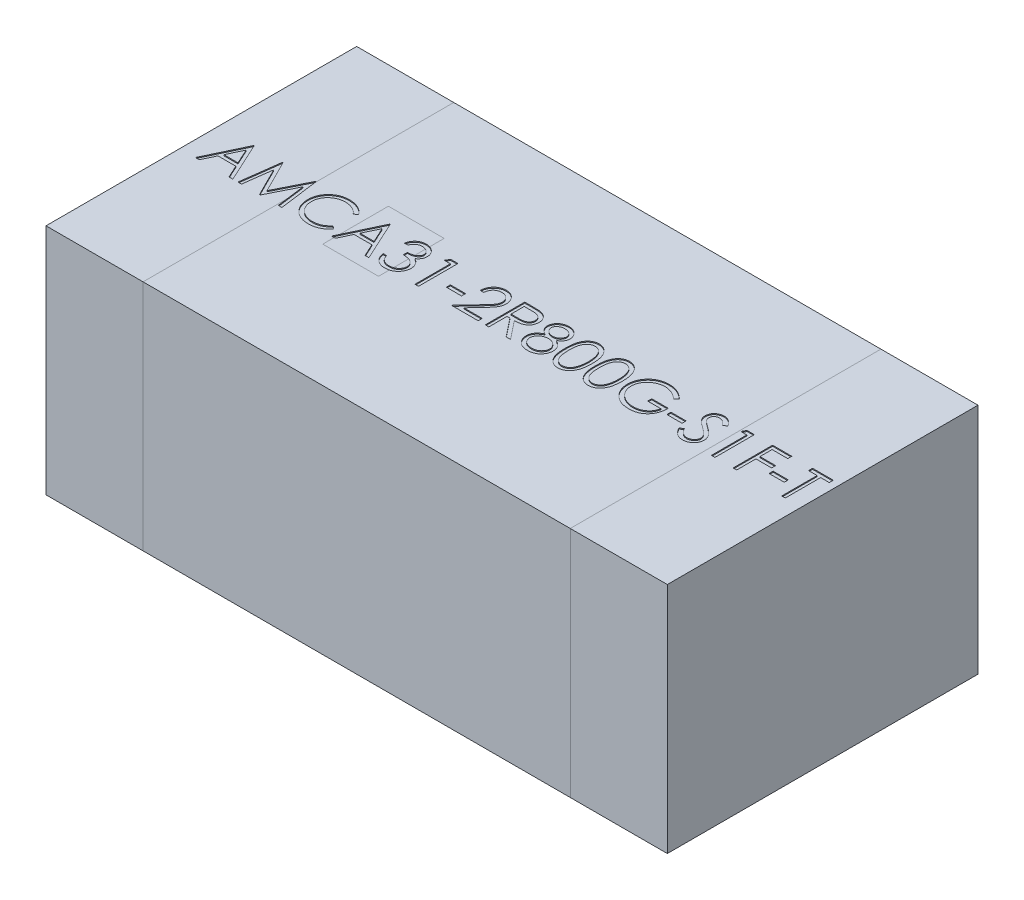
SolidWorks part; units mm, degrees
ref_plane "Front Plane" through (0, 0, 0) normal (0, 0, 1) x (1, 0, 0)
ref_plane "Top Plane" through (0, 0, 0) normal (0, 1, 0) x (1, 0, 0)
ref_plane "Right Plane" through (0, 0, 0) normal (1, 0, 0) x (0, 0, -1)
sketch "Sketch1" plane through (0, 0, 0) normal (0, 1, 0) x (1, 0, 0)
  line L0 (0, 7.4141) -> (0, -8.3625) construction
  line L1 (0, -55) -> (0, 55) construction
  line L2 (10.2951, 0) -> (-9.1134, 0) construction
  line L3 (-55, 0) -> (55, 0) construction
  line L5 (-1.6, 0.8) -> (1.6, 0.8)
  line L6 (-1.6, 0.8) -> (-1.6, -0.8)
  line L7 (-1.6, -0.8) -> (1.6, -0.8)
  line L8 (1.6, 0.8) -> (1.6, -0.8)
  dimension "D1" = 3.2
  dimension "D2" = 1.6
extrude "Boss-Extrude1" add sketch "Sketch1" along normal mid plane 1.2
ref_plane "Plane1" through (-1.1, 0, 0) normal (-1, 0, 0) x (0, 0, 1)
ref_plane "Plane2" through (1.1, 0, 0) normal (1, 0, 0) x (0, 0, -1)
sketch "Sketch18" plane through (0, 0.6, 0) normal (0, 1, 0) x (1, 0, 0)
  text T0 "AMCA31-2R800G-S1F-T" font "Century Gothic" height 0.2032
extrude "Cut-Extrude1" cut sketch "Sketch18" against normal blind 0.005
sketch "Sketch19" plane through (0, 0.6, 0) normal (0, 1, 0) x (1, 0, 0)
  line L0 (-0.1598, 0) -> (0.3658, 0) construction
  line L1 (-0.8056, 0.169) -> (-0.5186, 0.169)
  line L2 (-0.8056, 0.169) -> (-0.8056, -0.169)
  line L3 (-0.8056, -0.169) -> (-0.5186, -0.169)
  line L4 (-0.5186, 0.169) -> (-0.5186, -0.169)
